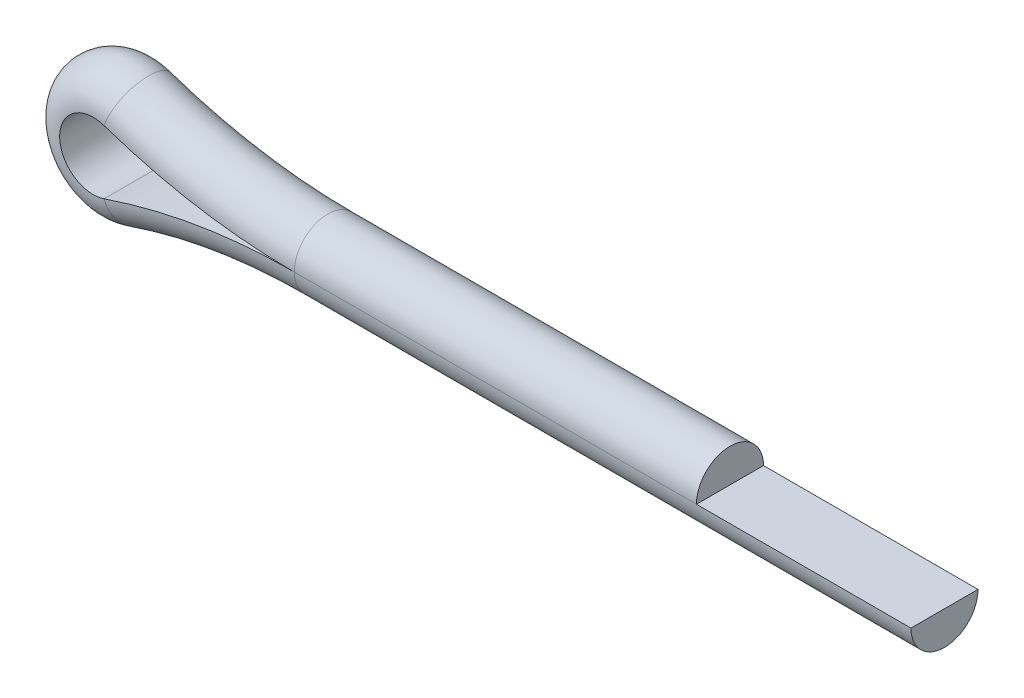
SolidWorks part; units mm, degrees
ref_plane "Front" through (0, 0, 0) normal (0, 0, 1) x (1, 0, 0)
ref_plane "Top" through (0, 0, 0) normal (0, 1, 0) x (1, 0, 0)
ref_plane "Right" through (0, 0, 0) normal (1, 0, 0) x (0, 0, -1)
ref_plane "Plane1" through (5, 0, 0) normal (1, 0, 0) x (0, 0, -1)
sketch "PathSke" plane through (1.208, 1.808, 0) normal (0, 0, 1) x (0, 1, 0)
  line L0 (-1.558, -3.792) -> (-1.558, -0.792)
  line L1 (-2.058, -0.792) -> (-2.058, -5.392)
  line L2 (-1.808, 1.208) -> (-1.808, -5.7761) construction
  arc A0 (-2.058, -0.792) -> (-2.2809, 0.5458) centre (-6.183, -0.792) ccw
  arc A1 (-1.558, -0.792) -> (-1.335, 0.5458) centre (2.567, -0.792) cw
  arc A3 (-1.335, 0.5458) -> (-2.2809, 0.5458) centre (-1.808, 0.708) ccw
  dimension "C" = 1
  dimension "d" = 0.5
  dimension "d/2" = 0.25
  dimension "l" = 3
  dimension "a" = 1.6
  dimension "b" = 2
sketch "SectionSke" plane through (5, 0.15, 0.15) normal (1, 0, 0) x (0, 1, 0)
  line L0 (-0.15, -0.4) -> (-0.15, 0.1)
  arc A0 (-0.15, -0.4) -> (-0.15, 0.1) centre (-0.15, -0.15) ccw
  dimension "R" = 0.25
  dimension "d1" = 0.5
sweep "Body" add profiles "SectionSke" path "PathSke"
equation "\"d/2@PathSke\" = \"d@PathSke\" / 2"
equation "\"R@SectionSke\" = \"d@PathSke\" / 2"
equation "\"d1@SectionSke\" = \"d@PathSke\""
equation "\"D1@Plane1\" = \"b@PathSke\" + \"l@PathSke\""
